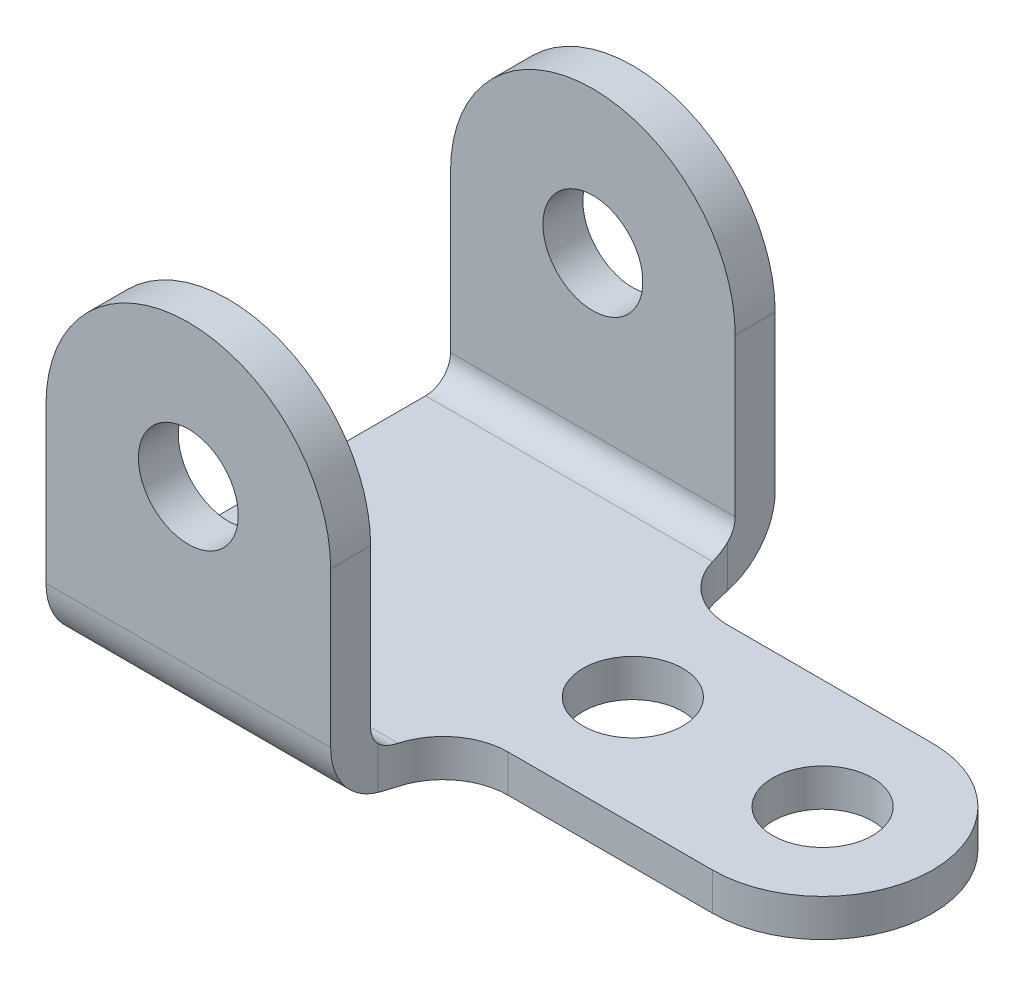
SolidWorks part; units mm, degrees
ref_plane "Front Plane" through (0, 0, 0) normal (0, 0, 1) x (1, 0, 0)
ref_plane "Top Plane" through (0, 0, 0) normal (0, 1, 0) x (1, 0, 0)
ref_plane "Right Plane" through (0, 0, 0) normal (1, 0, 0) x (0, 0, -1)
sketch "Sketch2" plane through (0, 0, 0) normal (0, 1, 0) x (1, 0, 0)
  line L0 (0, 89) -> (0, 0)
  line L2 (57, 0) -> (57, 22.5)
  line L3 (57, 22.5) -> (111, 22.5)
  line L4 (111, 66.5) -> (57, 66.5)
  line L6 (57, 89) -> (57, 66.5)
  line L8 (0, 89) -> (57, 89)
  line L9 (0, 0) -> (57, 0)
  arc A0 (111, 22.5) -> (111, 66.5) centre (111, 44.5) ccw
  circle A1 centre (111, 44.5) radius 10
  circle A2 centre (73, 44.5) radius 10
  dimension "D3" = 22
  dimension "D5" = 16
  dimension "D7" = 20
  dimension "D1" = 89
  dimension "D2" = 57
  dimension "D4" = 38
  dimension "D6" = 44.5
extrude "Boss-Extrude1" add sketch "Sketch2" along normal mid plane 7.5
fillet "Fillet2" radius 13 2 edges at (57, 0, -22.5) (57, 0, -66.5)
sketch "Sketch4" plane through (0, 0, 0) normal (0, 0, -1) x (1, 0, 0)
  line L4 (0, -3.75) -> (0, -40.25)
  line L5 (57, -40.25) -> (57, -3.75)
  line L6 (57, -3.75) -> (0, -3.75)
  arc A2 (0, -40.25) -> (57, -40.25) centre (28.5, -40.25) ccw
  circle A3 centre (28.5, -40.25) radius 10
  dimension "D6" = 20
  dimension "D4" = 36.5
extrude "Boss-Extrude2" add sketch "Sketch4" along normal blind 8
ref_plane "Plane1" through (0, 0, -44.5) normal (0, 0, -1) x (1, 0, 0)
mirror "Mirror2" about plane through (0, 0, -44.5) normal (0, 0, -1) of "Boss-Extrude2"
fillet "Fillet3" radius 5 2 edges at (28.5, 3.75, -81)
fillet "Fillet4" radius 13 2 edges at (28.5, -3.75, 0) (28.5, -3.75, -89)
